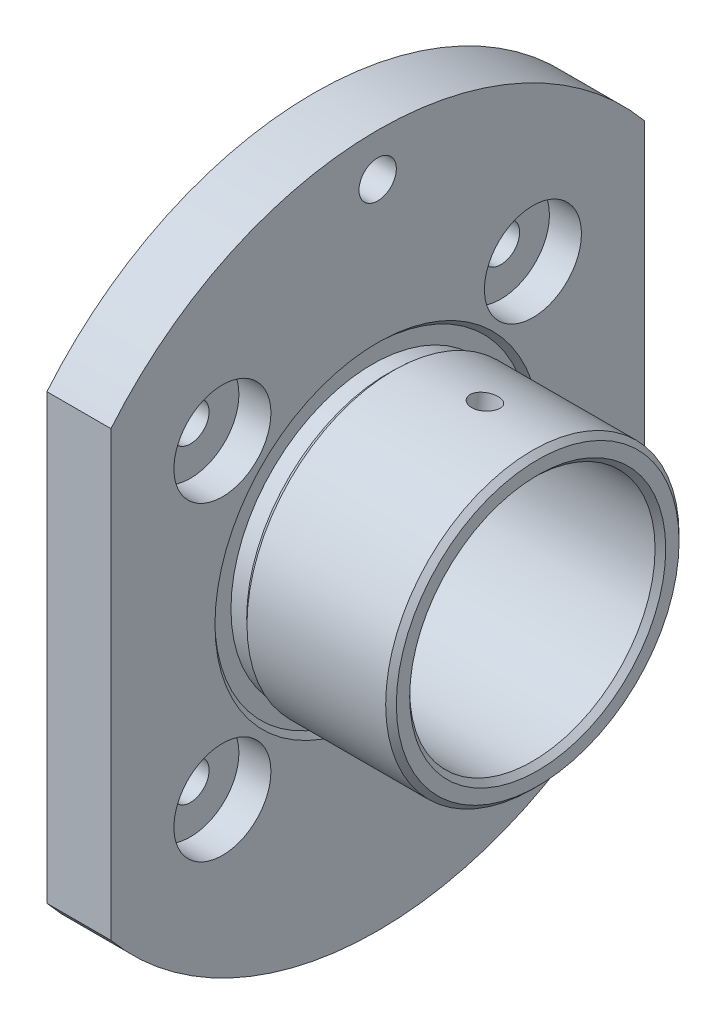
SolidWorks part; units mm, degrees
ref_plane "前视基准面" through (0, 0, 0) normal (0, 0, 1) x (1, 0, 0)
ref_plane "上视基准面" through (0, 0, 0) normal (0, 1, 0) x (1, 0, 0)
ref_plane "右视基准面" through (0, 0, 0) normal (1, 0, 0) x (0, 0, -1)
sketch "草图1" plane through (0, 0, 0) normal (0, 0, 1) x (1, 0, 0)
  line L0 (-67.2249, 0) -> (72.6498, 0) construction
  line L1 (-54.7519, 23) -> (-54.7519, 35)
  line L2 (-54.7519, 35) -> (-51.7519, 35)
  line L3 (-51.7519, 35) -> (-51.7519, 65)
  line L4 (-51.7519, 65) -> (-39.7519, 65)
  line L5 (-39.7519, 65) -> (-39.7519, 30.5)
  line L6 (-36.7519, 27.5) -> (-9.7519, 27.5)
  line L7 (-9.7519, 27.5) -> (-9.7519, 23)
  line L8 (-36.7519, 27.5) -> (-37.8058, 26.5)
  line L9 (-37.8058, 26.5) -> (-40.7519, 26.5)
  line L10 (-40.7519, 26.5) -> (-40.7519, 29.5511)
  line L11 (-40.7519, 29.5511) -> (-39.7519, 30.5)
  line L12 (-54.7519, 23) -> (-9.7519, 23)
  dimension "D1" = 23
  dimension "D2" = 45
  dimension "D5" = 3
  dimension "D6" = 12
  dimension "D7" = 1
  dimension "D8" = 1
revolve "旋转1" add sketch "草图1" angle 360 about L0
chamfer "倒角1" distance 1 angle 45 3 edges at (-54.7519, 0, 23) (-9.7519, 0, 23) (-9.7519, 0, 27.5)
hole_wizard "M6x1.0 螺纹孔1" positions "3D草图1" profile "草图2" tap size "M6x1.0" standard "Ansi Metric"
sketch3d "3D草图1"
  point P0 (-23.4047, 27.2397, -3.7745)
sketch "草图2" plane through (-23.4047, 27.2397, -3.7745) normal (1, 0, 0) x (0, 0.1373, 0.9905)
  line L0 (0, 0) -> (0, 16.5022)
  line L1 (0, 16.5022) -> (2.5, 15)
  line L2 (2.5, 15) -> (2.5, 0)
  line L5 (2.5, 0) -> (0, 0)
  line L10 (0, 16.5022) -> (-2.5, 15) construction
  line L11 (0, -6.35) -> (0, 107.95) construction
  dimension "螺纹孔钻头直径" = 5
  dimension "螺纹孔钻头深度" = 15
  dimension "导头角度" = 118
sketch "草图3" plane through (-39.7519, 0, 0) normal (1, 0, 0) x (0, 0, -1)
  line L0 (0, 69.1022) -> (0, -44.5994) construction
  line L1 (0, 0) -> (55.9373, -55.9373) construction
  line L2 (-81.4611, 0) -> (85.115, 0) construction
  line L3 (0, 0) -> (-61.966, -61.966) construction
  line L4 (0, 0) -> (-67.7589, 67.7589) construction
  line L5 (0, 0) -> (67.5439, 67.5439) construction
  circle A0 centre (0, 0) radius 57 construction
  circle A1 centre (0, 57) radius 3.5
  circle A2 centre (0, 0) radius 41.1587 construction
  circle A3 centre (-29.1036, 29.1036) radius 3.5
  circle A4 centre (29.1036, 29.1036) radius 3.5
  circle A5 centre (29.1036, -29.1036) radius 3.5
  circle A6 centre (-29.1036, -29.1036) radius 3.5
  dimension "D1" = 114
  dimension "D2" = 7
  dimension "D5" = 7
  dimension "D3" = 45
  dimension "D4" = 45
sketch "草图4" plane through (-39.7519, 0, 0) normal (1, 0, 0) x (0, 0, -1)
  circle A0 centre (-29.1036, 29.1036) radius 9.0931
  circle A1 centre (29.1036, 29.1036) radius 9.0931
  circle A2 centre (29.1036, -29.1036) radius 9.0931
  circle A3 centre (-29.1036, -29.1036) radius 9.0931
  dimension "D1" = 4
extrude "切除-拉伸1" cut sketch "草图3" against normal blind 20
extrude "切除-拉伸2" cut sketch "草图4" against normal blind 6
sketch "草图5" plane through (0, 0, 0) normal (1, 0, 0) x (0, 0, -1)
  line L0 (-50, 59.2151) -> (-50, -53.1969)
  line L1 (-50, -53.1969) -> (-89.5484, 5.9108)
  line L2 (-89.5484, 5.9108) -> (-50, 59.2151)
  line L3 (0, 0) -> (0, 48.8982) construction
  line L4 (50, -53.1969) -> (89.5484, 5.9108)
  line L5 (50, 59.2151) -> (50, -53.1969)
  line L6 (89.5484, 5.9108) -> (50, 59.2151)
  dimension "D1" = 50
extrude "切除-拉伸3" cut sketch "草图5" against normal blind 56
